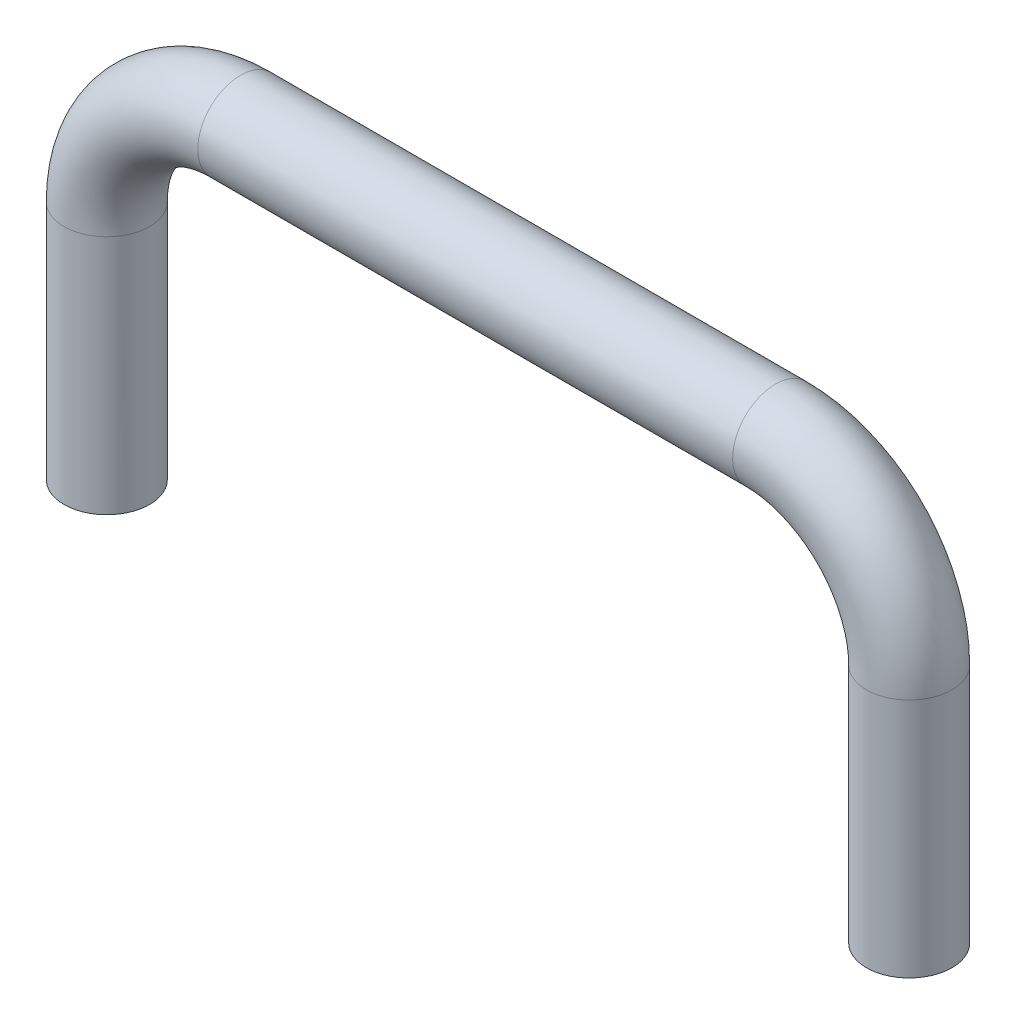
SolidWorks part; units mm, degrees
ref_plane "Plan de face" through (0, 0, 0) normal (0, 0, 1) x (1, 0, 0)
ref_plane "Plan de dessus" through (0, 0, 0) normal (0, 1, 0) x (1, 0, 0)
ref_plane "Plan de droite" through (0, 0, 0) normal (1, 0, 0) x (0, 0, -1)
sketch "Esquisse1" plane through (0, 0, 0) normal (0, 0, 1) x (1, 0, 0)
  line L0 (-75, 0) -> (-75, 45)
  line L1 (-50, 70) -> (50, 70)
  line L2 (75, 45) -> (75, 0)
  arc A0 (-75, 45) -> (-50, 70) centre (-50, 45) cw
  arc A1 (50, 70) -> (75, 45) centre (50, 45) cw
  point P7 (-75, 70)
  point P10 (75, 70)
  dimension "D3" = 25
  dimension "D1" = 70
  dimension "D2" = 150
  dimension "D4" = 75
sketch "Esquisse2" plane through (0, 0, 0) normal (0, 1, 0) x (1, 0, 0)
  circle A0 centre (-75, 0) radius 8
  dimension "D1" = 16
sweep "Balayage1" add profiles "Esquisse2" path "Esquisse1"
